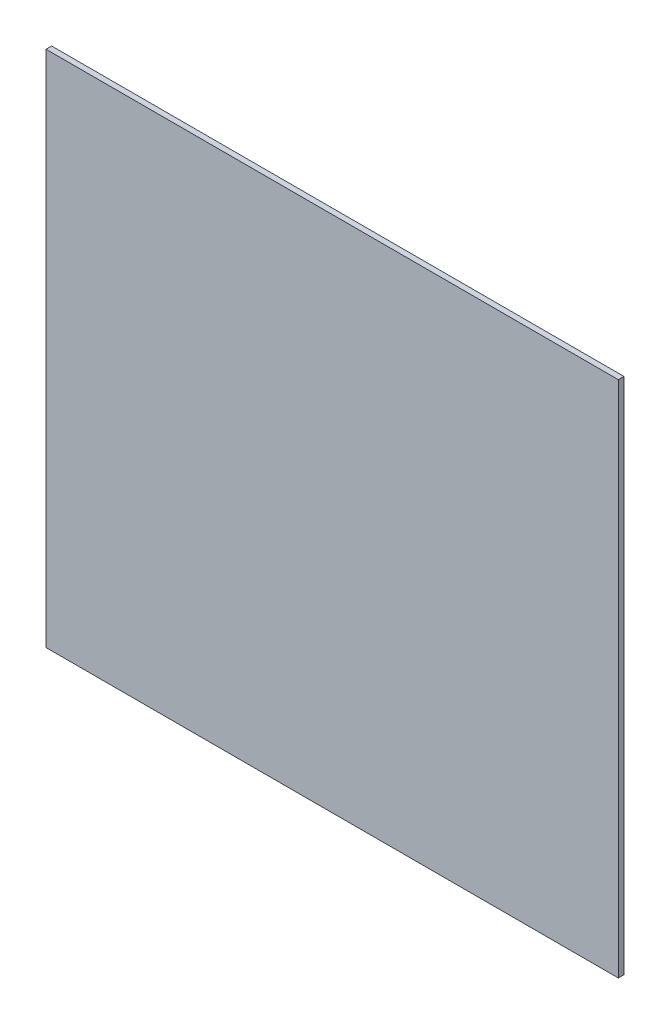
SolidWorks part; units mm, degrees
ref_plane "Ebene vorne" through (0, 0, 0) normal (0, 0, 1) x (1, 0, 0)
ref_plane "Ebene oben" through (0, 0, 0) normal (0, 1, 0) x (1, 0, 0)
ref_plane "Ebene rechts" through (0, 0, 0) normal (1, 0, 0) x (0, 0, -1)
sketch "Skizze1" plane through (0, 0, 0) normal (0, 0, 1) x (1, 0, 0)
  line L1 (-522.8529, -701.846) -> (-1537.8529, -701.846)
  line L2 (-522.8529, -701.846) -> (-522.8529, 217.154)
  line L3 (-522.8529, 217.154) -> (-1537.8529, 217.154)
  line L4 (-1537.8529, -701.846) -> (-1537.8529, 217.154)
  line L7 (-1531.8529, -701.846) -> (-528.8529, -701.846) construction
  line L8 (-1537.8529, 217.154) -> (-1537.8529, -707.846) construction
  line L9 (-522.8529, -707.846) -> (-522.8529, 217.154) construction
  line L10 (-522.8529, 217.154) -> (-1537.8529, 217.154) construction
extrude "Linear austragen1" add sketch "Skizze1" along normal blind 10
